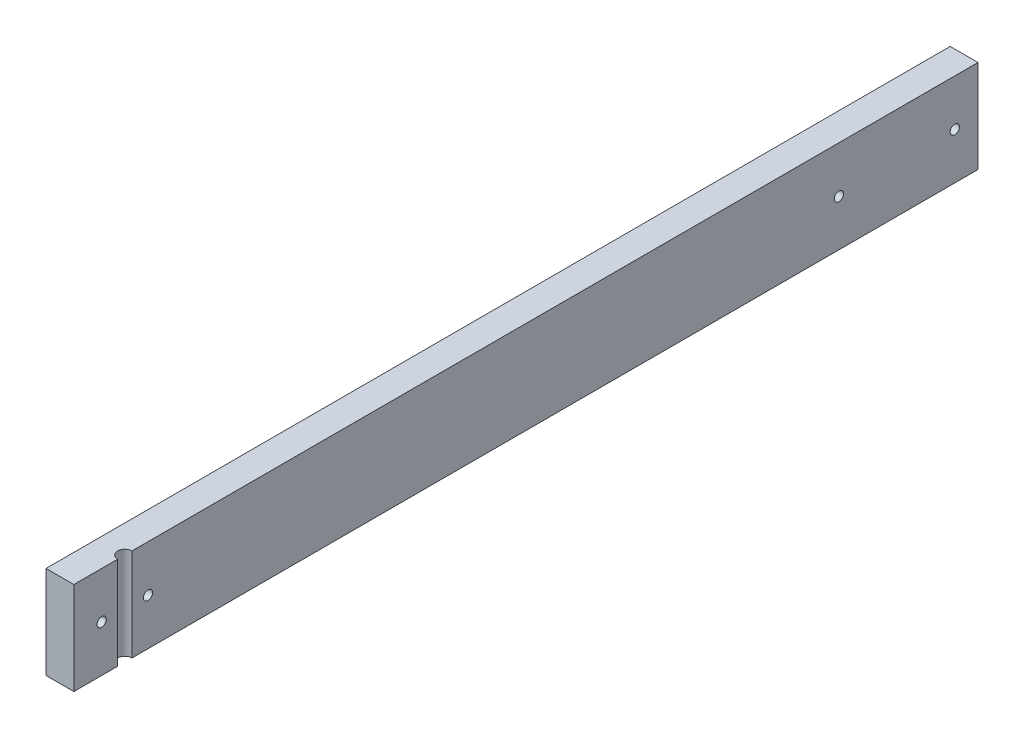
SolidWorks part; units mm, degrees
ref_plane "Plan de face" through (0, 0, 0) normal (0, 0, 1) x (1, 0, 0)
ref_plane "Plan de dessus" through (0, 0, 0) normal (0, 1, 0) x (1, 0, 0)
ref_plane "Plan de droite" through (0, 0, 0) normal (1, 0, 0) x (0, 0, -1)
sketch "Esquisse1" plane through (0, 0, 0) normal (1, 0, 0) x (0, 0, -1)
  line L0 (-8.7785, 10) -> (204.4142, 10) construction
  line L1 (0, 0) -> (195, 0)
  line L2 (0, 0) -> (0, 20)
  line L3 (0, 20) -> (195, 20)
  line L4 (195, 0) -> (195, 20)
  line L5 (6, -5.9745) -> (6, 29.8289) construction
  line L6 (16, 29.8289) -> (16, -5.9745) construction
  line L7 (195, -9.5329) -> (195, 32.9555) construction
  line L8 (190, 32.9555) -> (190, -9.5329) construction
  line L9 (165, -9.5329) -> (165, 32.9555) construction
  dimension "D1" = 5
  dimension "D2" = 25
extrude "Extrusion1" add sketch "Esquisse1" along normal blind 6
sketch "Esquisse2" plane through (6, 0, 0) normal (1, 0, 0) x (0, 0, -1)
  line L0 (-8.6334, 10) -> (203.4496, 10) construction
  line L1 (6, -5.1619) -> (6, 26.4484) construction
  line L2 (16, -5.1619) -> (16, 26.4484) construction
  line L3 (165, -5.1619) -> (165, 26.4484) construction
  line L4 (190, 26.4484) -> (190, -5.1619) construction
  circle A0 centre (6, 10) radius 1
  circle A1 centre (16, 10) radius 1
  circle A2 centre (165, 10) radius 1
  circle A3 centre (190, 10) radius 1
extrude "Enlèv. mat.-Extru.1" cut sketch "Esquisse2" against normal blind 2
sketch "Esquisse4" plane through (0, 20, 0) normal (0, 1, 0) x (-1, 0, 0)
  line L0 (6.2114, 0) -> (-12.6643, 0) construction
  line L1 (-6, 6.3211) -> (-6, -30.0252) construction
  line L2 (-12.6643, -11) -> (6.2114, -11) construction
  line L3 (-6, -9.45) -> (-6, -12.55)
  arc A0 (-6, -12.55) -> (-6, -9.45) centre (-6, -11) ccw
extrude "Enlèv. mat.-Extru.3" cut sketch "Esquisse4" against normal through all
